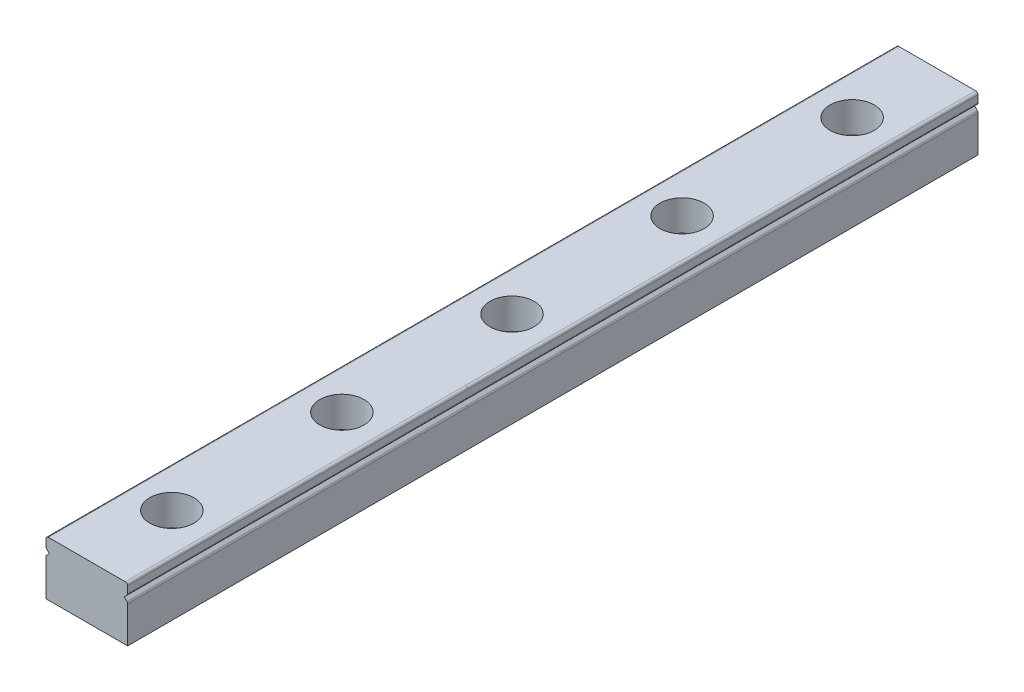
SolidWorks part; units mm, degrees
ref_plane "Front" through (0, 0, 0) normal (0, 0, 1) x (1, 0, 0)
ref_plane "Top" through (0, 0, 0) normal (0, 1, 0) x (1, 0, 0)
ref_plane "Right" through (0, 0, 0) normal (1, 0, 0) x (0, 0, -1)
sketch "Sketch2" plane through (0, 0, 0) normal (0, 0, 1) x (1, 0, 0)
  line L0 (5.5, 6) -> (6, 5.5)
  line L1 (0, 8) -> (6, 8)
  line L2 (0, 8) -> (0, 0)
  line L3 (0, 0) -> (6, 0)
  line L4 (6, 0) -> (6, 5.5)
  line L5 (6, 8) -> (6, 6.5)
  line L6 (6, 6.5) -> (5.5, 6)
  dimension "D1" = 8
  dimension "D2" = 6
  dimension "D3" = 1
  dimension "D4" = 1.5
extrude "Extrude3" add sketch "Sketch2" along normal blind 75
fillet "Fillet1" radius 0.35 3 edges at (6, 8, 37.5) (6, 6.5, 37.5) (6, 5.5, 37.5)
mirror "Mirror1" about plane through (0, 0, 0) normal (1, 0, 0) of "Fillet1", "Extrude3"
hole_wizard "CBORE for M3 SBHCS1" positions "Sketch4" profile "Sketch3" counterbore size "M3" standard "Ansi Metric"
sketch "Sketch4" plane through (0, 8, 0) normal (0, 1, 0) x (-1, 0, 0)
  point P0 (0, 12.5)
  dimension "D1" = 12.5
sketch "Sketch3" plane through (0, 8, 12.5) normal (1, 0, 0) x (0, 0, 1)
  line L0 (0, 0) -> (0, 8)
  line L1 (0, 8) -> (1.75, 8)
  line L3 (1.75, 8) -> (1.75, 4.5)
  line L4 (1.75, 4.5) -> (3.25, 4.5)
  line L5 (3.25, 4.5) -> (3.25, 0)
  line L7 (3.25, 0) -> (0, 0)
  line L11 (0, -6.35) -> (0, 107.95) construction
  dimension "Thru Hole Dia." = 3.5
  dimension "Thru Hole Depth" = 8
  dimension "C'Bore Dia." = 6.5
  dimension "C'Bore Depth" = 4.5
pattern_linear "LPattern3" count 3 spacing 25 along (0, 0, 1) of "CBORE for M3 SBHCS1"
mirror "Mirror2" about plane through (0, 0, 0) normal (0, 0, 1) of "LPattern3", "CBORE for M3 SBHCS1", "Mirror1", "Fillet1", "Extrude3"
sketch "Sketch5" plane through (0, 0, 0) normal (0, 1, 0) x (1, 0, 0)
  line L0 (5.65, -75) -> (-5.65, -75) construction
  line L1 (-20.7186, -50) -> (20.8957, -50)
  line L2 (-20.7186, -50) -> (-20.7186, -142.5692)
  line L3 (-20.7186, -142.5692) -> (20.8957, -142.5692)
  line L4 (20.8957, -50) -> (20.8957, -142.5692)
  circle A1 centre (0, -62.5) radius 3.25 construction
  dimension "D1" = 12.5
  dimension "D2" = 25
extrude "Cut-Extrude2" cut sketch "Sketch5" along normal through all
